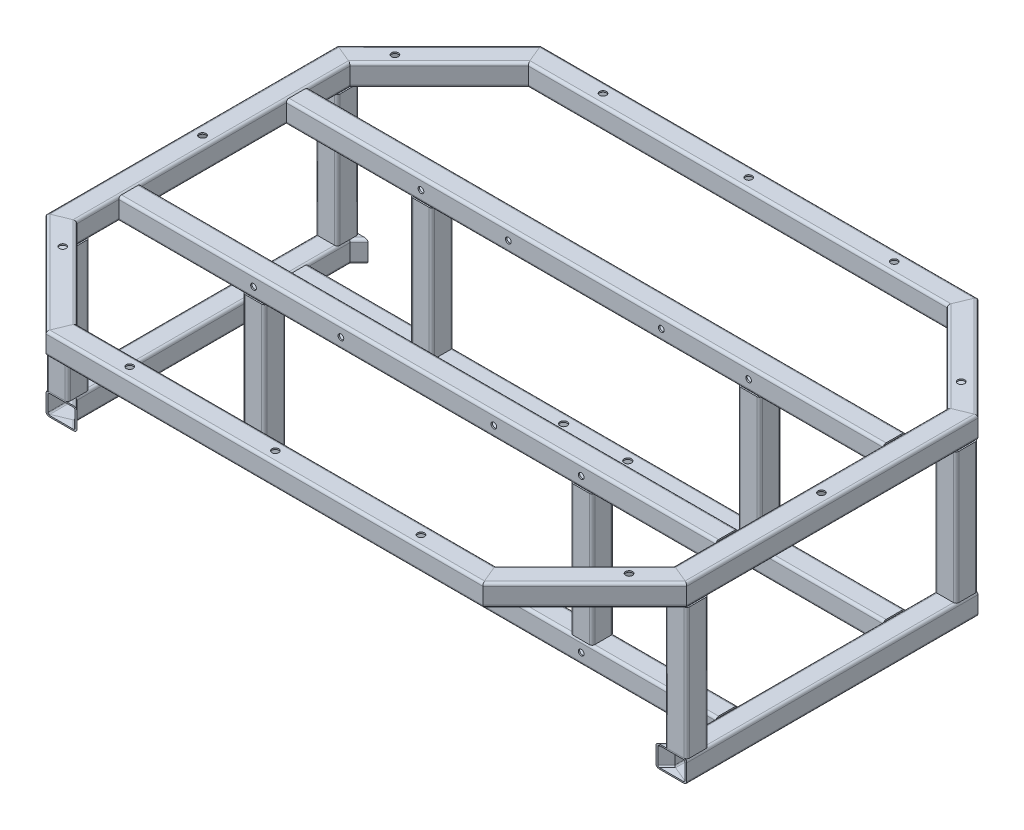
SolidWorks part; units mm, degrees
other "Marca1"
sketch "Croquis1"
other "Marca2"
sketch "Croquis2" [suppressed] plane through (279.4, 203.2, 215.9) normal (0.8898, 0.4543, 0.0428) x (0.048, 0, -0.9988)
ref_plane "Alzado" through (0, 0, 0) normal (0, 0, 1) x (1, 0, 0)
ref_plane "Planta" through (0, 0, 0) normal (0, 1, 0) x (1, 0, 0)
ref_plane "Vista lateral" through (0, 0, 0) normal (1, 0, 0) x (0, 0, -1)
sketch3d "Croquis3D1"
  line L0 (-279.4, 0, 0) -> (279.4, 0, 0) construction
  line L1 (0, 0, 215.9) -> (0, 0, -215.9) construction
  line L2 (0, 0, 0) -> (0, 152.4, 0) construction
  line L3 (-279.4, 0, 127) -> (-279.4, 0, -127)
  line L4 (-279.4, 0, -127) -> (-190.5, 0, -215.9)
  line L5 (-190.5, 0, -215.9) -> (190.5, 0, -215.9)
  line L6 (-279.4, 0, -127) -> (-279.4, 152.4, -127)
  line L7 (-114.3, 0, -215.9) -> (-114.3, 152.4, -215.9)
  line L8 (-190.5, 0, -215.9) -> (-190.5, 152.4, -215.9)
  line L9 (-190.5, 0, -215.9) -> (-279.4, 0, -215.9) construction
  line L10 (-279.4, 0, -215.9) -> (-279.4, 0, -127) construction
  line L11 (-190.5, 0, -215.9) -> (-114.3, 0, -215.9)
  line L12 (-114.3, 0, -215.9) -> (-63.5, 0, -190.5) construction
  line L13 (-63.5, 0, -190.5) -> (63.5, 0, -190.5) construction
  line L14 (-190.5, 152.4, -215.9) -> (-279.4, 152.4, -127)
  line L15 (-279.4, 0, 215.9) -> (-279.4, 0, 127) construction
  line L16 (-190.5, 0, 215.9) -> (-279.4, 0, 215.9) construction
  line L17 (-190.5, 0, 215.9) -> (190.5, 0, 215.9)
  line L18 (-114.3, 0, 215.9) -> (-114.3, 152.4, 215.9)
  line L19 (-190.5, 0, 215.9) -> (-114.3, 0, 215.9)
  line L20 (-114.3, 0, 215.9) -> (-63.5, 0, 190.5) construction
  line L21 (-279.4, 0, 127) -> (-190.5, 0, 215.9)
  line L22 (-190.5, 0, 215.9) -> (-190.5, 152.4, 215.9)
  line L23 (-190.5, 152.4, 215.9) -> (-279.4, 152.4, 127)
  line L24 (-279.4, 0, 127) -> (-279.4, 152.4, 127)
  line L25 (190.5, 0, 215.9) -> (279.4, 0, 215.9) construction
  line L26 (279.4, 0, -215.9) -> (279.4, 0, -127) construction
  line L27 (190.5, 0, -215.9) -> (279.4, 0, -215.9) construction
  line L28 (279.4, 0, 127) -> (279.4, 152.4, 127)
  line L29 (190.5, 152.4, 215.9) -> (279.4, 152.4, 127)
  line L30 (190.5, 0, 215.9) -> (190.5, 152.4, 215.9)
  line L31 (279.4, 0, 127) -> (190.5, 0, 215.9)
  line L32 (114.3, 0, 215.9) -> (63.5, 0, 190.5) construction
  line L33 (190.5, 0, 215.9) -> (114.3, 0, 215.9)
  line L34 (114.3, 0, 215.9) -> (114.3, 152.4, 215.9)
  line L35 (114.3, 0, -215.9) -> (63.5, 0, -190.5) construction
  line L36 (190.5, 0, -215.9) -> (114.3, 0, -215.9)
  line L37 (190.5, 0, -215.9) -> (190.5, 152.4, -215.9)
  line L38 (114.3, 0, -215.9) -> (114.3, 152.4, -215.9)
  line L39 (279.4, 0, -127) -> (279.4, 152.4, -127)
  line L40 (279.4, 0, -127) -> (190.5, 0, -215.9)
  line L41 (279.4, 0, 127) -> (279.4, 0, -127)
  line L42 (-63.5, 0, 190.5) -> (63.5, 0, 190.5) construction
  line L43 (-190.5, 152.4, -215.9) -> (-114.3, 152.4, -215.9)
  line L44 (114.3, 152.4, -215.9) -> (190.5, 152.4, -215.9)
  line L45 (279.4, 152.4, -127) -> (190.5, 152.4, -215.9)
  line L46 (190.5, 152.4, 215.9) -> (114.3, 152.4, 215.9)
  line L47 (-114.3, 152.4, 215.9) -> (-190.5, 152.4, 215.9)
  line L48 (-279.4, 152.4, -127) -> (-279.4, 152.4, 127)
  line L49 (279.4, 152.4, 127) -> (279.4, 152.4, -127)
  line L52 (-279.4, 0, 127) -> (279.4, 0, 127) construction
  line L53 (279.4, 0, -127) -> (-279.4, 0, -127) construction
  line L54 (279.4, 0, 215.9) -> (279.4, 0, 127) construction
  line L55 (-152.4, 0, 215.9) -> (-152.4, 152.4, 215.9)
  line L57 (152.4, 0, 215.9) -> (152.4, 152.4, 215.9)
  line L59 (152.4, 0, -215.9) -> (152.4, 152.4, -215.9)
  line L60 (-152.4, 0, -215.9) -> (-152.4, 152.4, -215.9)
  line L63 (0, 0, -190.5) -> (0, 0, -127) construction
  line L64 (-190.5, 0, -215.9) -> (-190.5, 0, 215.9) construction
  line L65 (-190.5, 0, -215.9) -> (-190.5, 0, -63.5) construction
  line L66 (-190.5, 0, 127) -> (-279.4, 0, 127) construction
  line L67 (0, 0, 0) -> (0, 0, 190.5) construction
  line L68 (0, 0, -127) -> (0, 0, 0) construction
  line L69 (-190.5, 0, 215.9) -> (-190.5, 0, 63.5) construction
  line L70 (190.5, 0, 215.9) -> (190.5, 0, 63.5) construction
  line L71 (190.5, 0, 127) -> (279.4, 0, 127) construction
  line L72 (0, 0, -190.5) -> (0, 0, -127)
  line L73 (0, 0, 190.5) -> (0, 0, 127)
  line L74 (190.5, 0, -127) -> (279.4, 0, -127) construction
  line L75 (190.5, 0, -215.9) -> (190.5, 0, -63.5) construction
  line L76 (-190.5, 0, 190.5) -> (190.5, 0, 190.5) construction
  line L77 (-190.5, 152.4, -215.9) -> (190.5, 152.4, -215.9)
  line L78 (-190.5, 152.4, 215.9) -> (190.5, 152.4, 215.9)
  line L79 (-190.5, 0, -190.5) -> (190.5, 0, -190.5) construction
  line L80 (279.4, 152.4, -63.5) -> (-279.4, 152.4, -63.5)
  line L81 (279.4, 152.4, 63.5) -> (-279.4, 152.4, 63.5)
  line L82 (279.4, 0, -63.5) -> (-279.4, 0, -63.5) construction
  line L83 (279.4, 0, 63.5) -> (-279.4, 0, 63.5) construction
  line L84 (-279.4, 0, 63.5) -> (279.4, 0, 63.5)
  line L85 (-279.4, 0, -63.5) -> (279.4, 0, -63.5)
  line L86 (152.4, 0, -63.5) -> (152.4, 152.4, -63.5)
  line L87 (-190.5, 0, -127) -> (-279.4, 0, -127) construction
  line L88 (-190.5, 0, 127) -> (-279.4, 0, 127) construction
  line L89 (152.4, 0, 63.5) -> (152.4, 152.4, 63.5)
  line L90 (-152.4, 0, -63.5) -> (-152.4, 152.4, -63.5)
  line L91 (-152.4, 0, 63.5) -> (-152.4, 152.4, 63.5)
  point P4 (0, 0, 0)
  point P8 (0, 0, 0)
  point P20 (-152.4, 0, -215.9)
  point P26 (-152.4, 0, 215.9)
  point P42 (0, 0, -190.5)
  point P46 (152.4, 0, 215.9)
  point P70 (0, 0, 190.5)
  dimension "D1" = 431.8
  dimension "D2" = 558.8
  dimension "D3" = 152.4
  dimension "D4" = 45
  dimension "D5" = 254
  dimension "D6" = 127
  dimension "D7" = 228.6
  dimension "D8" = 25.4
  dimension "D9" = 152.4
  dimension "D10" = 127
other "Cadb .75C18(1)"
ref_plane "Plano1" through (269.875, 9.525, 127) normal (0, 0, -1) x (1, 0, 0)
sketch "Sketch12" plane through (269.875, 9.525, 127) normal (0, 0, -1) x (1, 0, 0)
  line L1 (-7.1628, -9.525) -> (7.1628, -9.525)
  line L2 (-9.525, -7.1628) -> (-9.525, 7.1628)
  line L3 (-7.1628, 9.525) -> (7.1628, 9.525)
  line L4 (9.525, -7.1628) -> (9.525, 7.1628)
  line L5 (-9.525, -9.525) -> (9.525, 9.525) construction
  line L6 (-9.525, 9.525) -> (9.525, -9.525) construction
  line L7 (-7.1628, -8.3312) -> (7.1628, -8.3312)
  line L8 (-8.3312, -7.1628) -> (-8.3312, 7.1628)
  line L9 (-7.1628, 8.3312) -> (7.1628, 8.3312)
  line L10 (8.3312, -7.1628) -> (8.3312, 7.1628)
  line L11 (-8.3312, -8.3312) -> (8.3312, 8.3312) construction
  line L12 (-8.3312, 8.3312) -> (8.3312, -8.3312) construction
  arc A0 (-7.1628, -9.525) -> (-9.525, -7.1628) centre (-7.1628, -7.1628) cw
  arc A1 (7.1628, -9.525) -> (9.525, -7.1628) centre (7.1628, -7.1628) ccw
  arc A2 (7.1628, 9.525) -> (9.525, 7.1628) centre (7.1628, 7.1628) cw
  arc A3 (-9.525, 7.1628) -> (-7.1628, 9.525) centre (-7.1628, 7.1628) cw
  arc A4 (-7.1628, -8.3312) -> (-8.3312, -7.1628) centre (-7.1628, -7.1628) cw
  arc A5 (7.1628, -8.3312) -> (8.3312, -7.1628) centre (7.1628, -7.1628) ccw
  arc A6 (7.1628, 8.3312) -> (8.3312, 7.1628) centre (7.1628, 7.1628) cw
  arc A7 (-8.3312, 7.1628) -> (-7.1628, 8.3312) centre (-7.1628, 7.1628) cw
  point P0 (0, 0)
  point P6 (0, 0)
  point P11 (0, -9.525)
  point P12 (9.525, 0)
  point P13 (0, 9.525)
  point P14 (-9.525, 0)
  point P39 (0, 0)
  dimension "Round" = 2.3622
  dimension "Espesors" = 1.1938
  dimension "LArgo" = 19.05
sketch "Sketch13" plane through (0, 19.05, 0) normal (0, 1, 0) x (1, 0, 0)
  line L0 (28, 73.025) -> (-28, 73.025) construction
  line L1 (0, 0) -> (38.1409, 0) construction
  line L2 (0, 82.55) -> (0, 63.5) construction
  line L3 (-260.35, 82.55) -> (260.35, 82.55) construction
  line L4 (-260.35, 63.5) -> (260.35, 63.5) construction
  line L5 (28, 206.375) -> (-28, 206.375) construction
  line L6 (0, 215.9) -> (0, 196.85) construction
  line L7 (-182.6092, 196.85) -> (182.6092, 196.85) construction
  line L8 (-190.5, 215.9) -> (190.5, 215.9) construction
  circle A0 centre (28, 73.025) radius 3.175
  circle A1 centre (-28, 73.025) radius 3.175
  circle A2 centre (-28, -73.025) radius 3.175
  circle A3 centre (28, -73.025) radius 3.175
  circle A4 centre (28, 206.375) radius 3.175
  circle A5 centre (-28, 206.375) radius 3.175
  circle A6 centre (-28, -206.375) radius 3.175
  circle A7 centre (28, -206.375) radius 3.175
  point P4 (0, 73.025)
  point P19 (0, 73.025)
  point P25 (0, 206.375)
  point P28 (0, 206.375)
  dimension "D1" = 6.35
  dimension "D2" = 56
extrude "Cut-Extrude1" cut sketch "Sketch13" against normal through all
sketch "Sketch14" plane through (0, 0, 82.55) normal (0, 0, 1) x (1, 0, 0)
  line L0 (189.5215, 0) -> (-189.5215, 0) construction
  line L1 (-152.4, 152.4) -> (152.4, 152.4) construction
  line L2 (-152.4, 152.4) -> (-152.4, 0) construction
  line L3 (-152.4, 0) -> (152.4, 0) construction
  line L4 (152.4, 152.4) -> (152.4, 0) construction
  line L5 (-152.4, 152.4) -> (152.4, 0) construction
  line L6 (-152.4, 0) -> (152.4, 152.4) construction
  line L7 (189.5215, 152.4) -> (-189.5215, 152.4) construction
  line L8 (152.4, 133.35) -> (152.4, 19.05) construction
  line L9 (0, 76.2) -> (0, 0) construction
  line L10 (0, 76.2) -> (152.4, 76.2) construction
  line L11 (-142.875, 142.875) -> (-66.675, 142.875) construction
  circle A0 centre (-142.875, 142.875) radius 2.5
  circle A1 centre (-66.675, 142.875) radius 2.5
  circle A2 centre (142.875, 142.875) radius 2.5
  circle A3 centre (66.675, 142.875) radius 2.5
  circle A4 centre (142.875, 9.525) radius 2.5
  circle A5 centre (66.675, 9.525) radius 2.5
  circle A6 centre (-142.875, 9.525) radius 2.5
  circle A7 centre (-66.675, 9.525) radius 2.5
  point P0 (0, 76.2)
  dimension "D2" = 5
  dimension "D1" = 9.525
  dimension "D3" = 9.525
  dimension "D5" = 76.2
  dimension "D4" = 2
extrude "Cut-Extrude2" cut sketch "Sketch14" against normal up to surface (165.1 mm away)
sketch "Sketch15" plane through (0, 152.4, 0) normal (0, 1, 0) x (1, 0, 0)
  line L0 (0, 0) -> (0, -206.375) construction
  line L9 (219.075, 206.375) -> (-219.075, 206.375) construction
  line L10 (219.075, 206.375) -> (219.075, -206.375) construction
  line L11 (219.075, -206.375) -> (-219.075, -206.375) construction
  line L14 (-219.075, 206.375) -> (-219.075, -206.375) construction
  line L16 (219.075, 206.375) -> (-219.075, -206.375) construction
  line L17 (219.075, -206.375) -> (-219.075, 206.375) construction
  line L18 (0, 0) -> (219.075, 0) construction
  line L19 (-228.6, -177.8) -> (-228.6, 177.8) construction
  line L20 (-228.6, 177.8) -> (-279.4, 127) construction
  line L21 (-279.4, 127) -> (-279.4, -127) construction
  line L22 (-279.4, -127) -> (-228.6, -177.8) construction
  line L23 (-279.4, -127) -> (-279.4, 127) construction
  line L24 (-190.5, -215.9) -> (-279.4, -127) construction
  line L25 (-277.0378, -126.0215) -> (-262.7122, -120.0877) construction
  line L26 (-269.875, 123.0546) -> (-269.875, -123.0546) construction
  line L27 (-277.0378, 126.0215) -> (-262.7122, 120.0877) construction
  line L30 (-279.4, 127) -> (-190.5, 215.9) construction
  circle A10 centre (0, -206.375) radius 3
  circle A11 centre (127, -206.375) radius 3
  circle A12 centre (-127, -206.375) radius 3
  circle A13 centre (0, 206.375) radius 3
  circle A14 centre (127, 206.375) radius 3
  circle A15 centre (-127, 206.375) radius 3
  circle A16 centre (-269.875, 0) radius 3
  circle A17 centre (-246.9289, -144.8289) radius 3
  circle A20 centre (269.875, 0) radius 3
  circle A22 centre (-246.9289, 144.8289) radius 3
  circle A23 centre (246.9289, 144.8289) radius 3
  circle A24 centre (246.9289, -144.8289) radius 3
  point P0 (0, 0)
  point P31 (-228.6, 0)
  dimension "D5" = 6
  dimension "D3" = 6
  dimension "D1" = 438.15
  dimension "D2" = 412.75
  dimension "D4" = 127
  dimension "D6" = 50.8
  dimension "D7" = 10.3536
extrude "Cut-Extrude3" cut sketch "Sketch15" against normal up to next
sketch "Croquis3" plane through (0, 0, 0) normal (0, 1, 0) x (1, 0, 0)
  line L1 (-172.5146, 164.5634) -> (172.5146, 164.5634) construction
  line L2 (-172.5146, 164.5634) -> (-172.5146, -164.5634) construction
  line L3 (-172.5146, -164.5634) -> (172.5146, -164.5634) construction
  line L4 (172.5146, 164.5634) -> (172.5146, -164.5634) construction
  line L5 (-172.5146, 164.5634) -> (172.5146, -164.5634) construction
  line L6 (-172.5146, -164.5634) -> (172.5146, 164.5634) construction
  line L7 (96.3146, 195.9384) -> (248.7146, 195.9384)
  line L8 (96.3146, 195.9384) -> (96.3146, 133.1884)
  line L9 (96.3146, 133.1884) -> (248.7146, 133.1884)
  line L10 (248.7146, 195.9384) -> (248.7146, 133.1884)
  line L11 (96.3146, 195.9384) -> (248.7146, 133.1884) construction
  line L12 (96.3146, 133.1884) -> (248.7146, 195.9384) construction
  line L13 (0, 0) -> (172.5146, 0) construction
  line L14 (0, 0) -> (0, 164.5634) construction
  line L15 (96.3146, -133.1884) -> (248.7146, -133.1884)
  line L16 (248.7146, -195.9384) -> (248.7146, -133.1884)
  line L17 (96.3146, -195.9384) -> (248.7146, -195.9384)
  line L18 (96.3146, -195.9384) -> (96.3146, -133.1884)
  line L19 (-96.3146, -195.9384) -> (-96.3146, -133.1884)
  line L20 (-96.3146, -195.9384) -> (-248.7146, -195.9384)
  line L21 (-248.7146, -195.9384) -> (-248.7146, -133.1884)
  line L22 (-96.3146, -133.1884) -> (-248.7146, -133.1884)
  line L23 (-96.3146, 133.1884) -> (-248.7146, 133.1884)
  line L24 (-248.7146, 195.9384) -> (-248.7146, 133.1884)
  line L25 (-96.3146, 195.9384) -> (-248.7146, 195.9384)
  line L26 (-96.3146, 195.9384) -> (-96.3146, 133.1884)
  point P0 (0, 0)
  dimension "D1" = 90
  dimension "D2" = 62.75
  dimension "D3" = 152.4
sketch "Croquis4" plane through (0, 0, 0) normal (1, 0, 0) x (0, 0, -1)
  line L0 (0, 0) -> (0, 150.0378) construction
  line L1 (127, 133.35) -> (231.7182, 133.35)
  line L2 (127, 133.35) -> (127, -19.0332)
  line L3 (127, -19.0332) -> (231.7182, -19.0332)
  line L4 (231.7182, 133.35) -> (231.7182, -19.0332)
  line L5 (127, 150.0378) -> (-127, 150.0378) construction
  line L6 (-127, -19.0332) -> (-231.7182, -19.0332)
  line L7 (-231.7182, 133.35) -> (-231.7182, -19.0332)
  line L8 (-127, 133.35) -> (-231.7182, 133.35)
  line L9 (-127, 133.35) -> (-127, -19.0332)
  line L10 (213.5378, 133.35) -> (126.0215, 133.35) construction
  line L11 (127, 133.35) -> (127, 19.05) construction
extrude "Cortar-Extruir1" cut sketch "Croquis4" against normal through all and the other way through all
